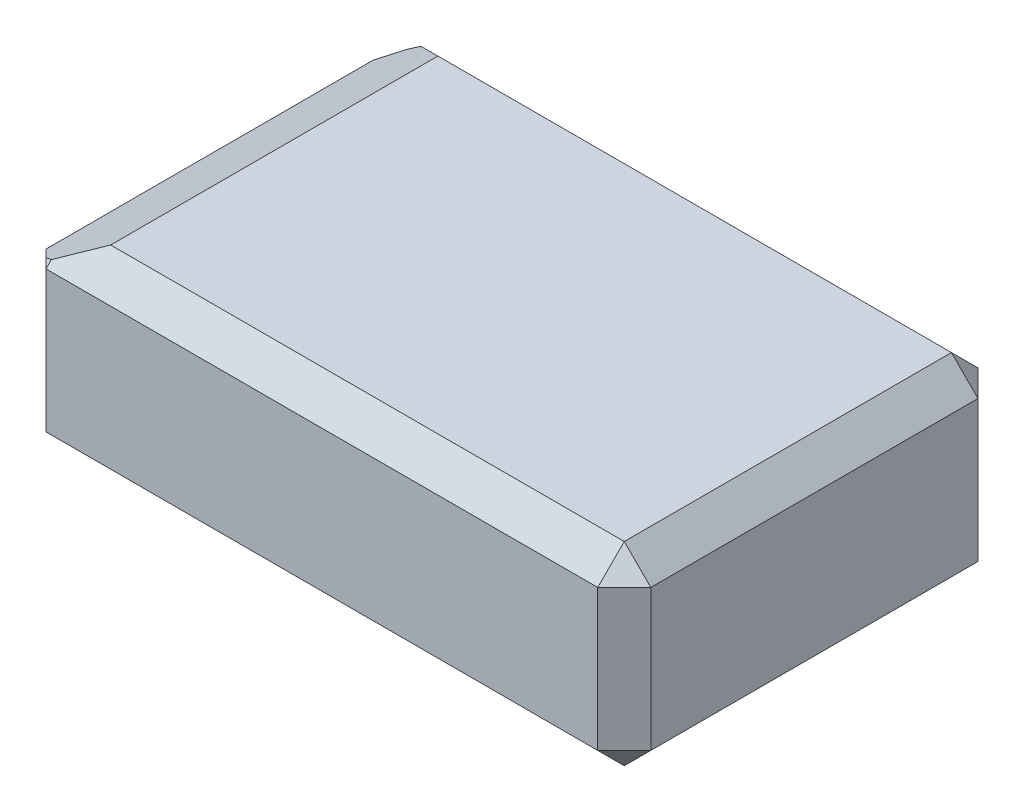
SolidWorks part; units mm, degrees
ref_plane "Front Plane" through (0, 0, 0) normal (0, 0, 1) x (1, 0, 0)
ref_plane "Top Plane" through (0, 0, 0) normal (0, 1, 0) x (1, 0, 0)
ref_plane "Right Plane" through (0, 0, 0) normal (1, 0, 0) x (0, 0, -1)
sketch "Sketch1" plane through (0, 0, 0) normal (0, 1, 0) x (1, 0, 0)
  line L1 (-114, 71.68) -> (114, 71.68)
  line L2 (-114, 71.68) -> (-114, -71.68)
  line L3 (-114, -71.68) -> (114, -71.68)
  line L4 (114, 71.68) -> (114, -71.68)
  line L5 (-114, 71.68) -> (114, -71.68) construction
  line L6 (-114, -71.68) -> (114, 71.68) construction
  point P0 (0, 0)
  dimension "D1" = 228
  dimension "D2" = 143.36
extrude "Boss-Extrude1" add sketch "Sketch1" along normal blind 73.22 contours L4 L3 L2 L1
chamfer "Chamfer1" distance 10 angle 45 12 edges at (0, 73.22, 71.68) (0, 73.22, -71.68) (114, 36.61, 71.68) (114, 73.22, 0) (114, 36.61, -71.68) (0, 0, 71.68) (114, 0, 0) (0, 0, -71.68) (-114, 36.61, -71.68) (-114, 73.22, 0) (-114, 36.61, 71.68) (-114, 0, 0)
ref_plane "Plane1" through (-155.6581, 36.61, 70.6436) normal (0.4848, -0.8746, 0) x (-0.8746, -0.4848, 0)
split "Split2" trim tools "Plane1" bodies to split 101 resulting bodies 105 106
delete or keep bodies "Body-Delete/Keep 1" type delete bodies bodies 106
split "Split1" trim tools "Plane1" bodies to split 105 101 resulting bodies 103
other "Cavity1"
other "Part5^Assem2<1>@Assem21"
